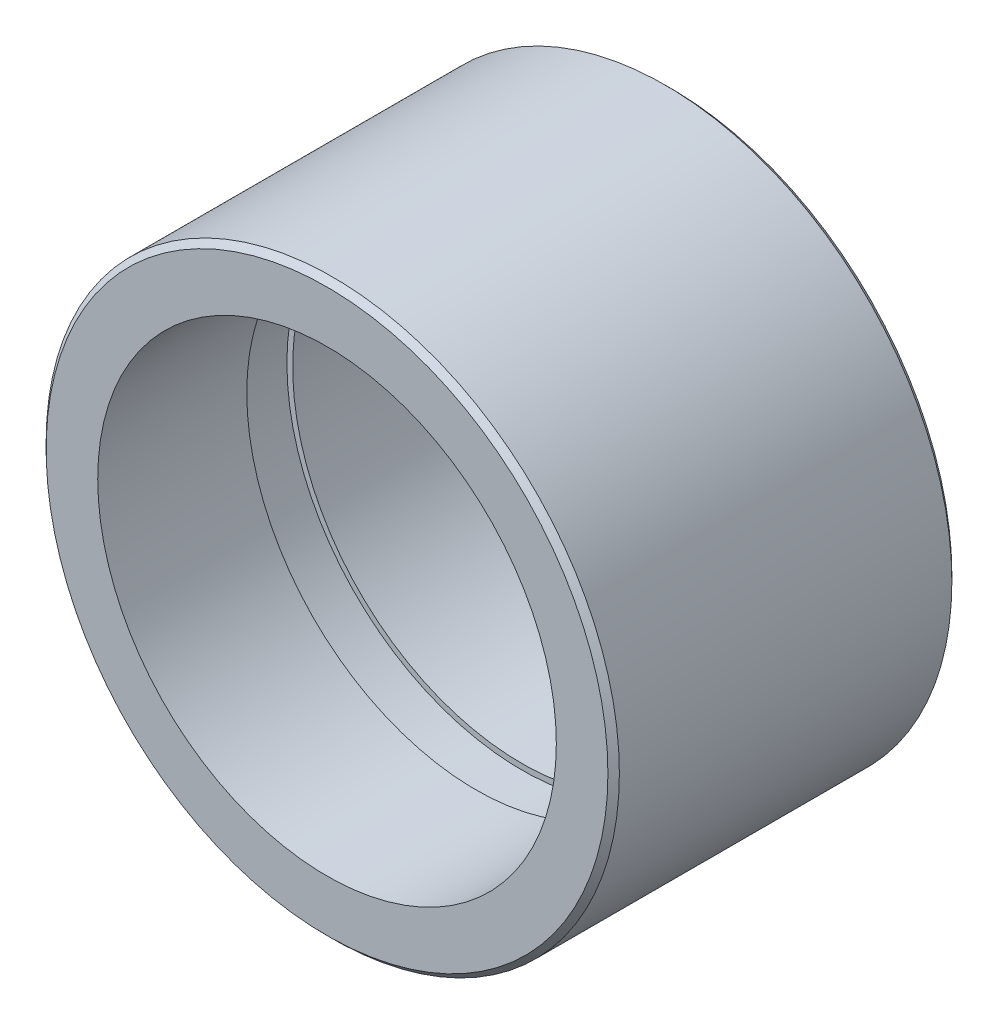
SolidWorks part; units mm, degrees
ref_plane "Plan de face" through (0, 0, 0) normal (0, 0, 1) x (1, 0, 0)
ref_plane "Plan de dessus" through (0, 0, 0) normal (0, 1, 0) x (1, 0, 0)
ref_plane "Plan de droite" through (0, 0, 0) normal (1, 0, 0) x (0, 0, -1)
sketch "Esquisse1" plane through (0, 0, 0) normal (0, 0, 1) x (1, 0, 0)
  circle A0 centre (0, 0) radius 50
  circle A1 centre (0, 0) radius 40
  dimension "D1" = 100
  dimension "D2" = 80
extrude "Extrusion1" add sketch "Esquisse1" along normal blind 60
sketch "Esquisse2" plane through (0, 0, 0) normal (1, 0, 0) x (0, 0, -1)
  line L0 (-60, 50) -> (-60, -50) construction
  line L1 (-34, 41) -> (-26, 41)
  line L2 (-34, 41) -> (-34, 30)
  line L3 (-34, 30) -> (-26, 30)
  line L4 (-26, 41) -> (-26, 30)
  dimension "D1" = 26
  dimension "D2" = 8
  dimension "D3" = 41
  dimension "D4" = 30
revolve "Enlèvement de matière-Révolution1" cut sketch "Esquisse2" angle 360 about axis through (0, 0, 60) along (0, 0, -1)
chamfer "Chanfrein1" distance 1 angle 45 2 edges at (50, 0, 60) (50, 0, 0)
